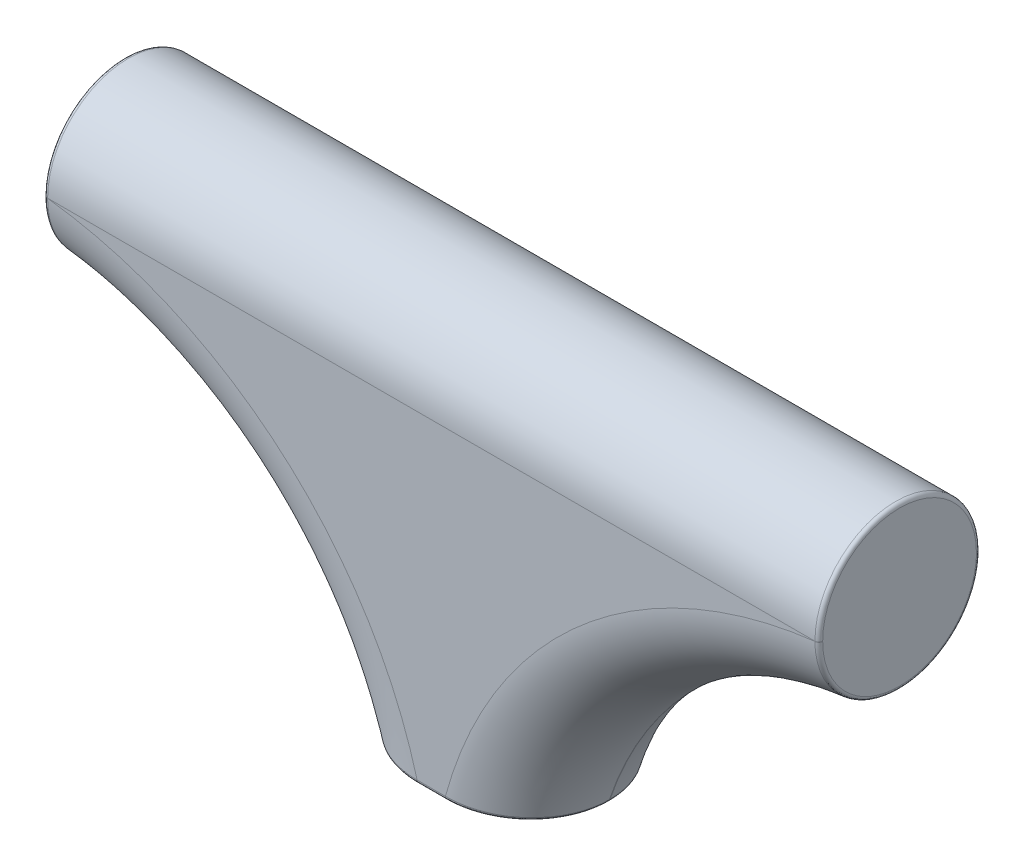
SolidWorks part; units mm, degrees
ref_plane "Front" through (0, 0, 0) normal (0, 0, 1) x (1, 0, 0)
ref_plane "Top" through (0, 0, 0) normal (0, 1, 0) x (1, 0, 0)
ref_plane "Right" through (0, 0, 0) normal (1, 0, 0) x (0, 0, -1)
sketch "Sketch1" plane through (0, 0, 0) normal (0, 0, 1) x (1, 0, 0)
  line L0 (0, 0) -> (0, -127) construction
  line L1 (-152.4, 31.75) -> (152.4, 31.75)
  line L2 (152.4, 31.75) -> (152.4, -31.75)
  line L5 (0, 0) -> (152.4, 0) construction
  line L6 (-152.4, 31.75) -> (-152.4, -31.75)
  line L9 (-38.1, -127) -> (38.1, -127)
  arc A0 (38.1, -127) -> (152.4, -31.75) centre (170.9485, -170.2132) cw
  arc A1 (-38.1, -127) -> (-152.4, -31.75) centre (-170.9485, -170.2132) ccw
  dimension "D4" = 139.7
  dimension "D1" = 76.2
  dimension "D2" = 304.8
  dimension "D3" = 63.5
  dimension "D5" = 127
extrude "Base-Extrude" add sketch "Sketch1" along normal mid plane 63.5
sketch "Sketch2" plane through (152.4, 0, 0) normal (1, 0, 0) x (0, 0, -1)
  line L0 (31.75, 31.75) -> (31.75, -31.75) construction
  line L1 (-31.75, 31.75) -> (-31.75, -31.75) construction
  line L2 (31.75, 57.15) -> (31.75, 0)
  line L3 (-31.75, 57.15) -> (-31.75, 0)
  line L5 (-31.75, 57.15) -> (31.75, 57.15)
  line L6 (-31.75, 57.15) -> (31.75, 57.15)
  arc A1 (31.75, 0) -> (-31.75, 0) centre (0, 0) ccw
  dimension "D2" = 25.4
extrude "Cut-Extrude1" cut sketch "Sketch2" against normal through all
sketch "Sketch3" plane through (0, -127, 0) normal (0, -1, 0) x (1, 0, 0)
  circle A0 centre (0, 0) radius 12.7
  dimension "D1" = 25.4
fillet "Fillet1" radius 31.623
fillet "Fillet2" radius 1.524
